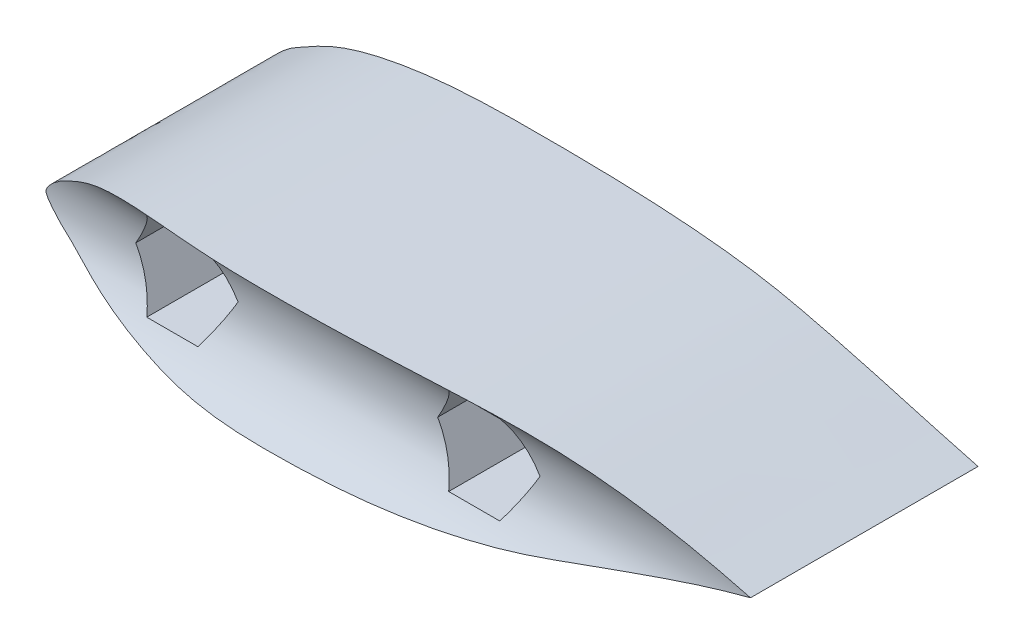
SolidWorks part; units mm, degrees
ref_plane "Front Plane" through (0, 0, 0) normal (0, 0, 1) x (1, 0, 0)
ref_plane "Top Plane" through (0, 0, 0) normal (0, 1, 0) x (1, 0, 0)
ref_plane "Right Plane" through (0, 0, 0) normal (1, 0, 0) x (0, 0, -1)
sketch "Sketch1" plane through (0, 0, 0) normal (0, 0, 1) x (1, 0, 0)
  line L0 (0, 0) -> (35, 0) construction
  spline S0 degree 3 poles (0, 0) (0.0077, 0.267) (0.7972, 0.8987) (1.41, 1.2361) (3.07, 2.2592) (7.5654, 3.3311) (13.3624, 3.4829) (22.29, 3.2653) (29.2938, 1.6521) (32.2346, 0.7179) (35, 0) knots 0 0 0 0 0.022524 0.034643 0.121186 0.243771 0.472973 0.711145 0.763848 1 1 1 1
  spline S1 degree 3 poles (0, 0) (0.0077, -0.267) (0.7972, -0.8987) (1.41, -1.2361) (3.07, -2.2592) (7.5654, -3.3311) (13.3624, -3.4829) (22.29, -3.2653) (29.2938, -1.6521) (32.2346, -0.7179) (35, 0) knots 0 0 0 0 0.022524 0.034643 0.121186 0.243771 0.472973 0.711145 0.763848 1 1 1 1
  point P3 (25.2737, 2.6828)
  point P5 (14.0993, 3.4046)
  point P7 (6.5071, 2.87)
  point P16 (2.8981, 2.0145)
  point P17 (6.4536, 2.9769)
  point P18 (0, 0)
  point P19 (25.8015, 2.4513)
extrude "Boss-Extrude1" add sketch "Sketch1" along normal blind 15
sketch "Sketch2" plane through (0, 0, 0) normal (1, 0, 0) x (0, 0, -1)
  line L0 (-15, 0) -> (0, 0) construction
  circle A0 centre (-15, 0) radius 3.7
extrude "Cut-Extrude1" cut sketch "Sketch2" along normal blind 35
ref_plane "Plane1" through (0, 0, 15) normal (0, 0, 1) x (1, 0, 0)
sketch "Sketch3" plane through (0, 0, 15) normal (0, 0, 1) x (1, 0, 0)
  line L0 (9.5403, 0) -> (8.2702, 2.2)
  line L1 (5.7298, 2.2) -> (4.4597, 0)
  line L2 (4.4597, 0) -> (5.7298, -2.2)
  line L3 (8.2702, -2.2) -> (9.5403, 0)
  line L4 (8.2702, 2.2) -> (5.7298, 2.2)
  line L5 (5.7298, -2.2) -> (8.2702, -2.2)
  line L7 (23.2702, -2.2) -> (24.5403, 0)
  line L9 (24.5403, 0) -> (23.2702, 2.2)
  line L11 (23.2702, 2.2) -> (20.7298, 2.2)
  line L13 (20.7298, 2.2) -> (19.4597, 0)
  line L15 (19.4597, 0) -> (20.7298, -2.2)
  line L17 (20.7298, -2.2) -> (23.2702, -2.2)
  point P5 (7, 0)
  point P17 (22, 0)
extrude "Cut-Extrude2" cut sketch "Sketch3" against normal blind 13
sketch "Sketch4" plane through (0, 0, 15) normal (0, 0, 1) x (1, 0, 0)
  circle A1 centre (7, 0) radius 1.1
  circle A2 centre (22, 0) radius 1.1
extrude "Cut-Extrude3" cut sketch "Sketch4" against normal blind 23
